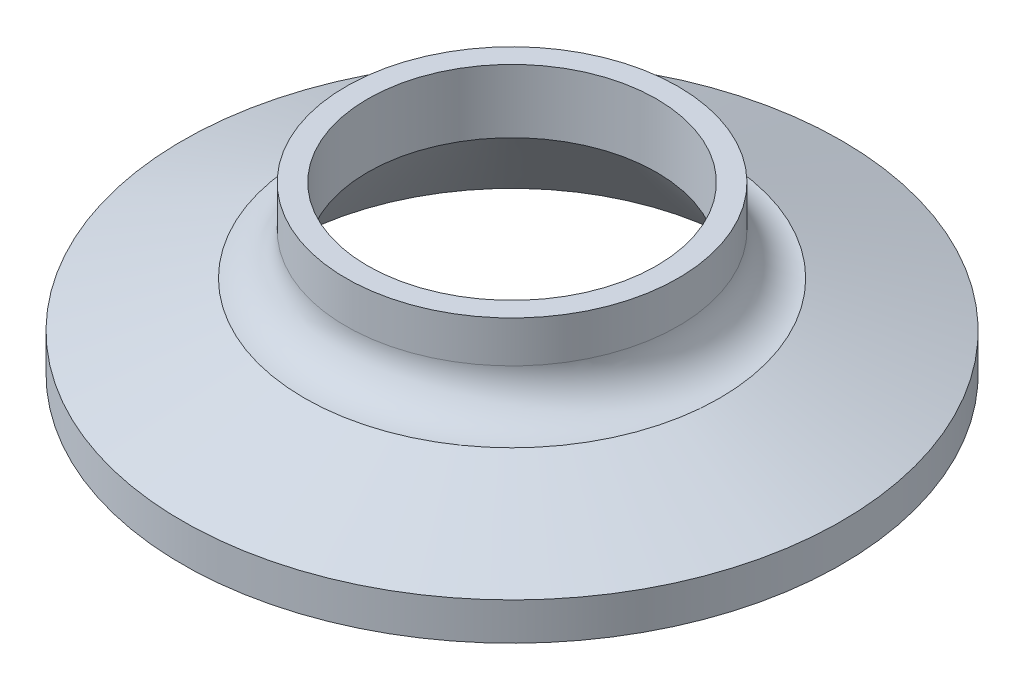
SolidWorks part; units mm, degrees
ref_plane "Front Plane" through (0, 0, 0) normal (0, 0, 1) x (1, 0, 0)
ref_plane "Top Plane" through (0, 0, 0) normal (0, 1, 0) x (1, 0, 0)
ref_plane "Right Plane" through (0, 0, 0) normal (1, 0, 0) x (0, 0, -1)
sketch "Sketch1" plane through (0, 0, 0) normal (0, 0, 1) x (1, 0, 0)
  line L0 (0, 0) -> (0, 8.8532) construction
  line L1 (-12.7, 12.7) -> (-12.7, 9.525)
  line L2 (-15.875, 6.35) -> (-15.6302, 6.35)
  line L3 (-15.6302, 6.35) -> (-25.1968, 2.868)
  line L4 (-25.1968, 2.868) -> (-25.1968, 0)
  line L5 (-25.1968, 0) -> (-23.8092, 0)
  line L6 (-19.828, 0) -> (-17.399, 0)
  line L10 (-17.399, 0) -> (-11.049, 7.845)
  line L11 (-11.049, 7.845) -> (-11.049, 12.7)
  line L12 (-11.049, 12.7) -> (-12.7, 12.7)
  line L15 (-22.9175, 0.8729) -> (-23.0844, 0.4797)
  line L17 (-20.7197, 0.8729) -> (-20.5528, 0.4797)
  arc A0 (-15.875, 6.35) -> (-12.7, 9.525) centre (-15.875, 9.525) ccw
  arc A1 (-23.0844, 0.4797) -> (-23.8092, 0) centre (-23.8092, 0.7874) cw
  arc A2 (-19.828, 0) -> (-20.5528, 0.4797) centre (-19.828, 0.7874) cw
  arc A3 (-20.7197, 0.8729) -> (-22.9175, 0.8729) centre (-21.8186, 0.4064) ccw
  dimension "D3" = 3.175
  dimension "D7" = 0.7874
  dimension "D8" = 21.8186
  dimension "D9" = 0.7874
  dimension "D2" = 11.049
  dimension "D4" = 12.7
  dimension "D5" = 6.35
  dimension "D6" = 25.1968
  dimension "D10" = 20
  dimension "D11" = 17.399
  dimension "D12" = 12.7
revolve "Revolve1" add sketch "Sketch1" angle 360 about L0
